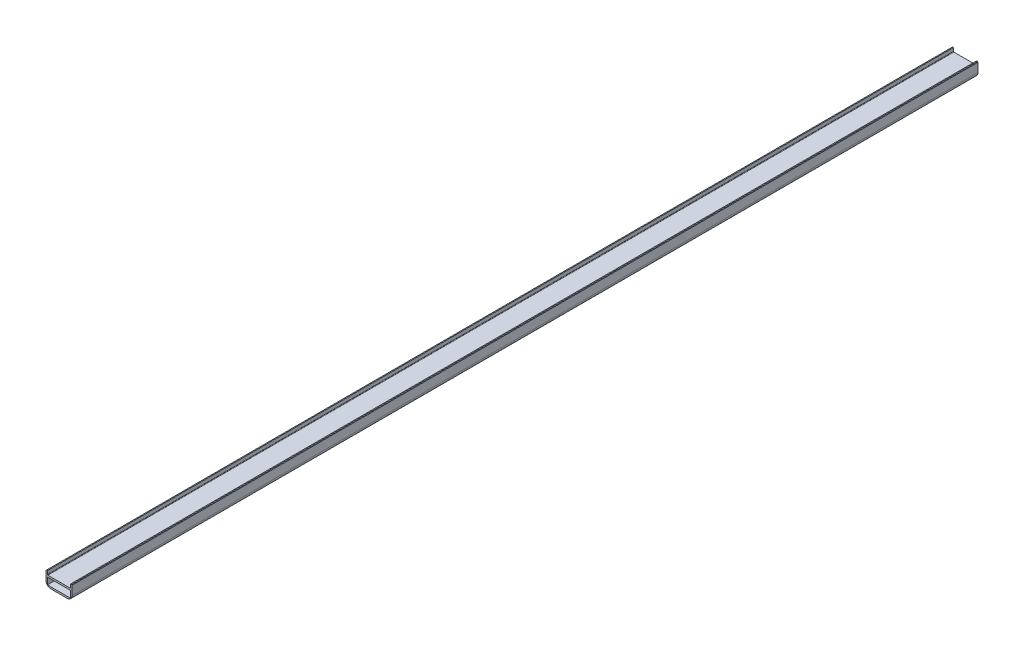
SolidWorks part; units mm, degrees
other "<Rubber Moulding>-<Cut-Extrude1>"
ref_plane "Front Plane" through (0, 0, 0) normal (0, 0, 1) x (1, 0, 0)
ref_plane "Top Plane" through (0, 0, 0) normal (0, 1, 0) x (1, 0, 0)
ref_plane "Right Plane" through (0, 0, 0) normal (1, 0, 0) x (0, 0, -1)
mirrored part "Rubber Moulding_Mirrored"
